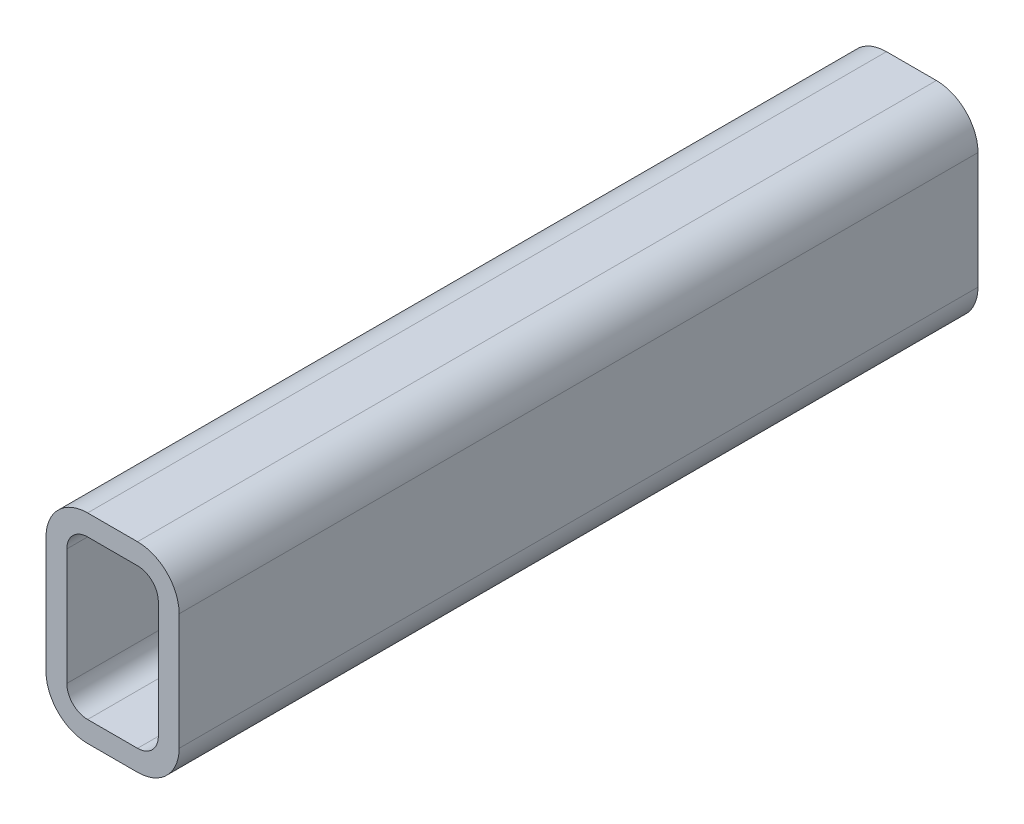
SolidWorks part; units mm, degrees
ref_plane "Front Plane" through (0, 0, 0) normal (0, 0, 1) x (1, 0, 0)
ref_plane "Top Plane" through (0, 0, 0) normal (0, 1, 0) x (1, 0, 0)
ref_plane "Right Plane" through (0, 0, 0) normal (1, 0, 0) x (0, 0, -1)
sketch "Sketch1" plane through (0, 0, 0) normal (0, 0, 1) x (1, 0, 0)
  line B0 (15.875, 76.2) -> (34.925, 76.2)
  arc B1 (50.8, 60.325) -> (34.925, 76.2) centre (34.925, 60.325) ccw
  line B2 (50.8, 60.325) -> (50.8, 15.875)
  arc B3 (34.925, 0) -> (50.8, 15.875) centre (34.925, 15.875) ccw
  line B4 (34.925, 0) -> (15.875, 0)
  arc B5 (0, 15.875) -> (15.875, 0) centre (15.875, 15.875) ccw
  line B6 (0, 15.875) -> (0, 60.325)
  arc B7 (15.875, 76.2) -> (0, 60.325) centre (15.875, 60.325) ccw
  line B8 (15.875, 68.2625) -> (34.925, 68.2625)
  arc B9 (42.8625, 60.325) -> (34.925, 68.2625) centre (34.925, 60.325) ccw
  line B10 (42.8625, 60.325) -> (42.8625, 15.875)
  arc B11 (34.925, 7.9375) -> (42.8625, 15.875) centre (34.925, 15.875) ccw
  line B12 (34.925, 7.9375) -> (15.875, 7.9375)
  arc B13 (7.9375, 15.875) -> (15.875, 7.9375) centre (15.875, 15.875) ccw
  line B14 (7.9375, 15.875) -> (7.9375, 60.325)
  arc B15 (15.875, 68.2625) -> (7.9375, 60.325) centre (15.875, 60.325) ccw
sketch_block_instance "HSS3x2x0.3125-1"
sketch_block "HSS3x2x0.3125"
extrude "Boss-Extrude1" add sketch "Sketch1" along normal blind 304.8
